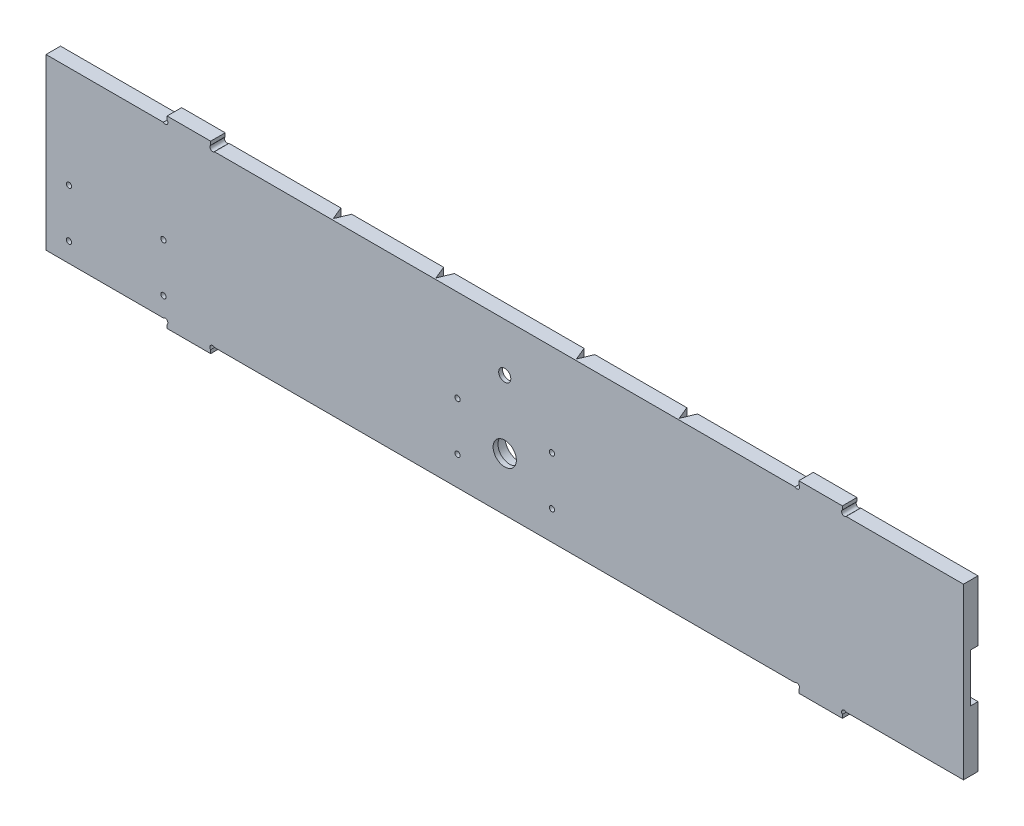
SolidWorks part; units mm, degrees
ref_plane "Plan de face" through (0, 0, 0) normal (0, 0, 1) x (1, 0, 0)
ref_plane "Plan de dessus" through (0, 0, 0) normal (0, 1, 0) x (1, 0, 0)
ref_plane "Plan de droite" through (0, 0, 0) normal (1, 0, 0) x (0, 0, -1)
sketch "Esquisse1" plane through (0, 0, 0) normal (0, 0, 1) x (1, 0, 0)
  line L0 (0, -6.6405) -> (0, 96.3518) construction
  line L1 (-29.9818, 0) -> (234.3455, 0) construction
  line L2 (118, 96.3518) -> (118, -6.6405) construction
  line L3 (160.43, 96.3518) -> (160.43, -6.6405) construction
  line L4 (189.43, 86.2709) -> (189.43, -6.6405) construction
  line L5 (-34.0225, 76) -> (230.3048, 76) construction
  line L6 (-22.502, 38) -> (149.1382, 38) construction
  line L7 (-26.3453, 73) -> (187.5054, 73) construction
  line L8 (59, 88.6513) -> (59, 68.5321) construction
  line L9 (50, 84.1592) -> (50, 68.5321) construction
  line L10 (50, 73) -> (41.1873, 81.8127) construction
  line L11 (50, 74.5556) -> (50, 76)
  line L12 (68, 74.5556) -> (68, 76)
  line L13 (50, 76) -> (68, 76)
  line L14 (50, 0) -> (68, 0)
  line L15 (68, 1.4444) -> (68, 0)
  line L16 (50, 1.4444) -> (50, 0)
  line L17 (48.4444, 73) -> (0, 73)
  line L18 (0, 73) -> (0, 3)
  line L19 (48.4444, 3) -> (0, 3)
  line L20 (330.4156, 3) -> (378.86, 3)
  line L21 (378.86, 73) -> (378.86, 3)
  line L22 (330.4156, 73) -> (378.86, 73)
  line L23 (328.86, 1.4444) -> (328.86, 0)
  line L24 (310.86, 1.4444) -> (310.86, 0)
  line L25 (328.86, 0) -> (310.86, 0)
  line L26 (328.86, 76) -> (310.86, 76)
  line L27 (310.86, 74.5556) -> (310.86, 76)
  line L28 (328.86, 74.5556) -> (328.86, 76)
  line L29 (69.5556, 73) -> (309.3044, 73)
  line L30 (69.5556, 3) -> (309.3044, 3)
  line L31 (207.0462, 25) -> (142.367, 25) construction
  line L32 (200.2917, 53) -> (129.5064, 53) construction
  line L33 (208.93, 6.5252) -> (208.93, 19.9164) construction
  line L34 (211.93, 38) -> (166.93, 38) construction
  line L35 (211.93, 38) -> (211.93, 12) construction
  line L36 (211.93, 12) -> (166.93, 12) construction
  line L37 (166.93, 38) -> (166.93, 12) construction
  line L38 (211.93, 38) -> (166.93, 12) construction
  line L39 (211.93, 12) -> (166.93, 38) construction
  line L40 (218.2222, 15) -> (206.1554, 15) construction
  line L41 (6.5, -6.1575) -> (6.5, 53.483) construction
  line L42 (-12.2463, 21) -> (60.0864, 21) construction
  line L43 (29, 21) -> (29, 46.0735) construction
  line L44 (51.5, 34) -> (6.5, 34) construction
  line L45 (51.5, 34) -> (51.5, 8) construction
  line L46 (51.5, 8) -> (6.5, 8) construction
  line L47 (6.5, 34) -> (6.5, 8) construction
  line L48 (51.5, 34) -> (6.5, 8) construction
  line L49 (51.5, 8) -> (6.5, 34) construction
  line L50 (54.5948, 11) -> (29, 11) construction
  line L51 (48.5, 7.0605) -> (48.5, 24.6109) construction
  arc A0 (48.4444, 73) -> (50, 74.5556) centre (49.2222, 73.7778) ccw
  arc A1 (69.5556, 73) -> (68, 74.5556) centre (68.7778, 73.7778) cw
  arc A2 (69.5556, 3) -> (68, 1.4444) centre (68.7778, 2.2222) ccw
  arc A3 (48.4444, 3) -> (50, 1.4444) centre (49.2222, 2.2222) cw
  arc A4 (330.4156, 3) -> (328.86, 1.4444) centre (329.6378, 2.2222) ccw
  arc A5 (309.3044, 3) -> (310.86, 1.4444) centre (310.0822, 2.2222) cw
  arc A6 (309.3044, 73) -> (310.86, 74.5556) centre (310.0822, 73.7778) ccw
  arc A7 (330.4156, 73) -> (328.86, 74.5556) centre (329.6378, 73.7778) cw
  circle A8 centre (189.43, 25) radius 4.8
  circle A9 centre (189.43, 53) radius 2.5
  circle A10 centre (208.93, 15) radius 1.1
  circle A11 centre (169.93, 15) radius 1.1
  circle A12 centre (208.93, 35) radius 1.1
  circle A13 centre (169.93, 35) radius 1.1
  circle A14 centre (48.5, 11) radius 1.1
  circle A15 centre (9.5, 11) radius 1.1
  circle A16 centre (9.5, 31) radius 1.1
  circle A17 centre (48.5, 31) radius 1.1
  point P87 (29, 21)
  dimension "D10" = 25
  dimension "D11" = 23
  dimension "D14" = 6.5
  dimension "D1" = 76
  dimension "D2" = 118
  dimension "D3" = 29
  dimension "D4" = 42.43
  dimension "D5" = 38
  dimension "D6" = 59
  dimension "D7" = 9
  dimension "D8" = 3
  dimension "D9" = 45
  dimension "D12" = 3
  dimension "D13" = 3
  dimension "D15" = 18
  dimension "D16" = 22.5
  dimension "D17" = 3
  dimension "D18" = 3
extrude "Boss.-Extru.1" add sketch "Esquisse1" along normal blind 6
sketch "Esquisse2" plane through (0, 0, 0) normal (0, 0, -1) x (-1, 0, 0)
  circle A0 centre (-189.43, 25) radius 5.95
extrude "Enlèv. mat.-Extru.1" cut sketch "Esquisse2" against normal blind 4
sketch "Esquisse3" plane through (0, 0, 0) normal (0, 0, -1) x (-1, 0, 0)
  line L0 (-189.43, -9.5867) -> (-189.43, 53.6573) construction
  line L1 (-372.86, -9.5867) -> (-372.86, 76.0824) construction
  line L2 (-378.86, 38) -> (-388.8996, 38) construction
  line L3 (-378.86, 3) -> (-378.86, 73) construction
  line L4 (-386.5356, 28) -> (-361.5243, 28) construction
  line L5 (-372.86, 28) -> (-380.9385, 36.0785) construction
  line L6 (-372.86, 45.7373) -> (-372.86, 30.2627)
  line L7 (-375.1227, 48) -> (-378.86, 48)
  line L8 (-378.86, 48) -> (-378.86, 28)
  line L9 (-378.86, 28) -> (-375.1227, 28)
  line L10 (0, 28) -> (-3.7373, 28)
  line L11 (0, 48) -> (0, 28)
  line L12 (-3.7373, 48) -> (0, 48)
  line L13 (-6, 45.7373) -> (-6, 30.2627)
  arc A0 (-375.1227, 28) -> (-372.86, 30.2627) centre (-373.9914, 29.1314) ccw
  arc A1 (-375.1227, 48) -> (-372.86, 45.7373) centre (-373.9914, 46.8686) cw
  arc A2 (-3.7373, 48) -> (-6, 45.7373) centre (-4.8686, 46.8686) ccw
  arc A3 (-3.7373, 28) -> (-6, 30.2627) centre (-4.8686, 29.1314) cw
  dimension "D1" = 6
  dimension "D2" = 45
  dimension "D3" = 10
extrude "Enlèv. mat.-Extru.2" cut sketch "Esquisse3" against normal blind 3
sketch "Esquisse4" plane through (0, 3, 0) normal (0, -1, 0) x (1, 0, 0)
  line L0 (378.86, 12.6487) -> (378.86, -42.1719) construction
  line L1 (260.86, 12.6487) -> (260.86, -42.1719) construction
  line L2 (218.43, 12.6487) -> (218.43, -42.1719) construction
  line L3 (189.43, 6) -> (189.43, -31.6414) construction
  line L4 (69.5556, 6) -> (309.3044, 6) construction
  line L5 (256.5818, 5.4) -> (239.7003, 5.4) construction
  line L6 (260.86, 5.4) -> (264.721, -3.9214) construction
  line L7 (239.645, -27.9045) -> (239.645, 2.0916) construction
  line L8 (260.86, 5.4) -> (263.18, -0.201)
  line L9 (260.86, 5.4) -> (258.54, -0.201)
  line L10 (263.18, -0.201) -> (258.54, -0.201)
  line L11 (216.11, -0.201) -> (220.75, -0.201)
  line L12 (218.43, 5.4) -> (220.75, -0.201)
  line L13 (218.43, 5.4) -> (216.11, -0.201)
  line L14 (160.43, 5.4) -> (162.75, -0.201)
  line L15 (160.43, 5.4) -> (158.11, -0.201)
  line L16 (162.75, -0.201) -> (158.11, -0.201)
  line L17 (115.68, -0.201) -> (120.32, -0.201)
  line L18 (118, 5.4) -> (120.32, -0.201)
  line L19 (118, 5.4) -> (115.68, -0.201)
  dimension "D1" = 118
  dimension "D2" = 42.43
  dimension "D3" = 21.215
  dimension "D4" = 0.6
  dimension "D5" = 22.5
extrude "Enlèv. mat.-Extru.3" cut sketch "Esquisse4" against normal through all
sketch "Esquisse5" plane through (0, 0, 0) normal (0, 0, -1) x (-1, 0, 0)
  circle A0 centre (-189.43, 53) radius 12
extrude "Enlèv. mat.-Extru.4" cut sketch "Esquisse5" against normal blind 4.4
